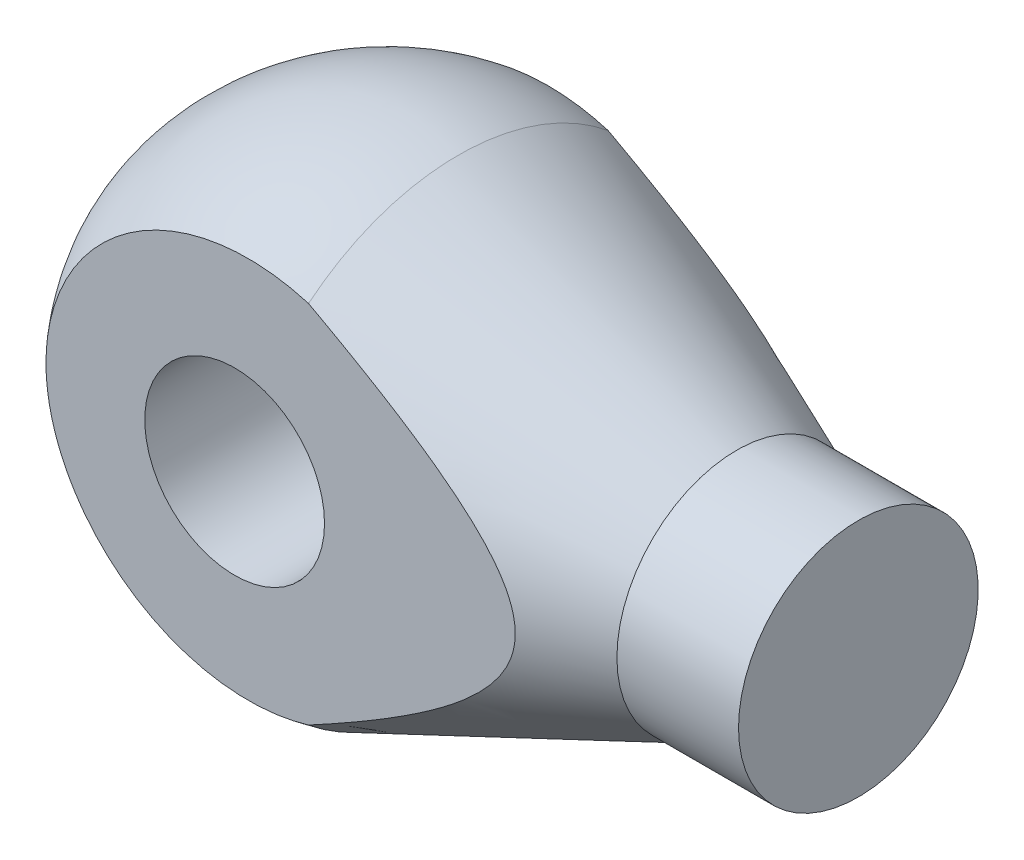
SolidWorks part; units mm, degrees
ref_plane "前视基准面" through (0, 0, 0) normal (0, 0, 1) x (1, 0, 0)
ref_plane "上视基准面" through (0, 0, 0) normal (0, 1, 0) x (1, 0, 0)
ref_plane "右视基准面" through (0, 0, 0) normal (1, 0, 0) x (0, 0, -1)
sketch "草图1" plane through (0, 0, 0) normal (0, 1, 0) x (1, 0, 0)
  line L0 (-80.8691, 0) -> (68.5426, 0) construction
  line L1 (56.2967, 0) -> (56.2967, 20)
  line L2 (56.2967, 20) -> (35.9985, 20)
  line L3 (35.9985, 20) -> (-10.466, 39.4098)
  line L4 (56.2967, 0) -> (-64.7822, 0)
  arc A0 (-10.466, 39.4098) -> (-64.7822, 0) centre (-20.503, -3.8922) ccw
  dimension "D1" = 20
revolve "旋转1" add sketch "草图1" angle 360 about L0
sketch "草图2" plane through (0, 0, 0) normal (0, 0, 1) x (1, 0, 0)
  line L0 (-10.466, 43.8116) -> (-10.466, 49.5717) construction
  line L2 (-10.466, 49.5717) -> (-10.466, -50.0953) construction
  line L3 (29.2165, 0) -> (-74.8143, 0) construction
  circle A0 centre (-22.7989, 0) radius 15
  point P8 (-10.466, -0.2618)
  point P9 (-10.466, 0)
  dimension "D1" = 30
extrude "切除-拉伸1" cut sketch "草图2" against normal mid plane 100
sketch "草图3" plane through (0, 0, 0) normal (1, 0, 0) x (0, 0, -1)
  line L0 (0, 49.2226) -> (0, -49.2226) construction
  line L1 (-55.993, 47.8262) -> (-25, 47.8262)
  line L2 (-55.993, 47.8262) -> (-55.993, -48.0008)
  line L3 (-55.993, -48.0008) -> (-25, -48.0008)
  line L4 (-25, 47.8262) -> (-25, -48.0008)
  line L5 (55.993, -48.0008) -> (25, -48.0008)
  line L6 (25, 47.8262) -> (25, -48.0008)
  line L7 (55.993, 47.8262) -> (25, 47.8262)
  line L8 (55.993, 47.8262) -> (55.993, -48.0008)
  dimension "D1" = 25
extrude "切除-拉伸3" cut sketch "草图3" against normal blind 61 and the other way blind 27
